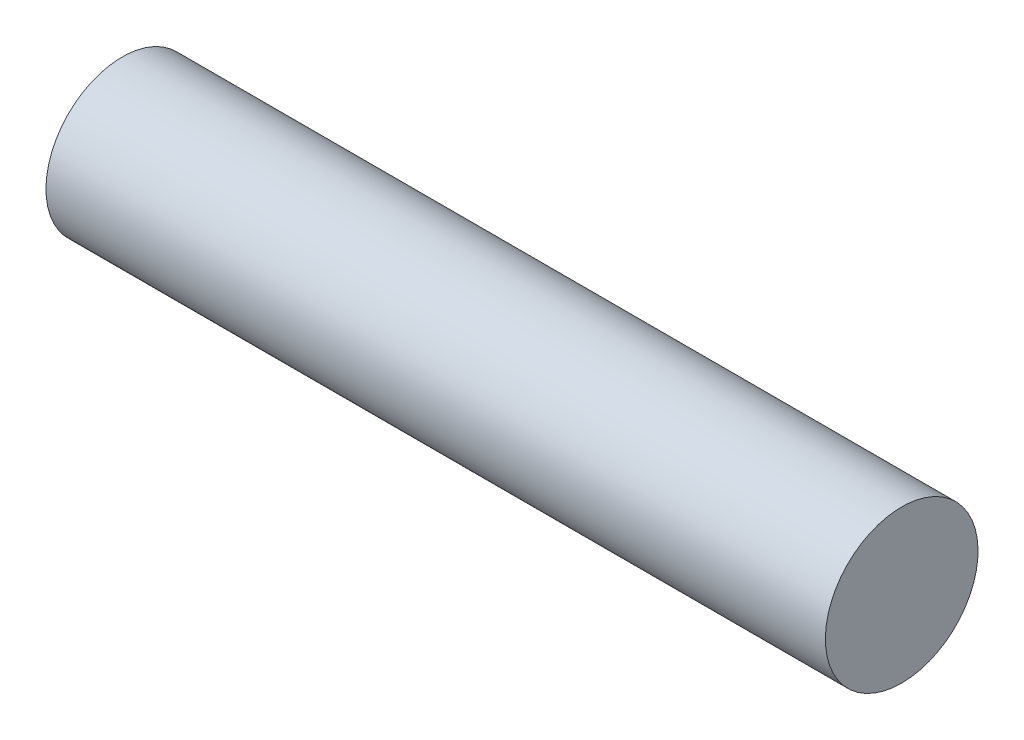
SolidWorks part; units mm, degrees
ref_plane "Front Plane" through (0, 0, 0) normal (0, 0, 1) x (1, 0, 0)
ref_plane "Top Plane" through (0, 0, 0) normal (0, 1, 0) x (1, 0, 0)
ref_plane "Right Plane" through (0, 0, 0) normal (1, 0, 0) x (0, 0, -1)
sketch "Sketch1" plane through (0, 0, 0) normal (0, 0, 1) x (1, 0, 0)
  line L0 (0, 0) -> (0, 2.9845)
  line L1 (0, 2.9845) -> (30.48, 2.9845)
  line L2 (30.48, 2.9845) -> (30.48, 0)
  line L3 (30.48, 0) -> (0, 0)
  line L4 (30.48, 0) -> (0, 0) construction
  dimension "D1" = 2.9845
  dimension "D2" = 30.48
revolve "Revolve1" add sketch "Sketch1" angle 360 about L4
